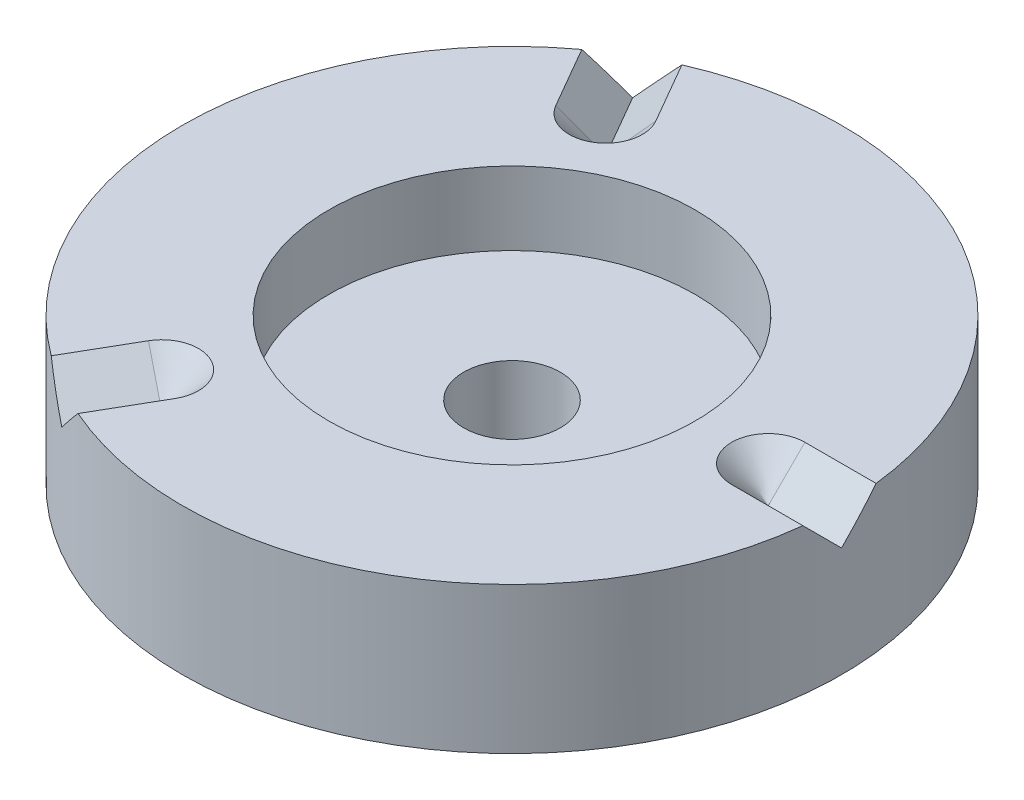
SolidWorks part; units mm, degrees
ref_plane "Front Plane" through (0, 0, 0) normal (0, 0, 1) x (1, 0, 0)
ref_plane "Top Plane" through (0, 0, 0) normal (0, 1, 0) x (1, 0, 0)
ref_plane "Right Plane" through (0, 0, 0) normal (1, 0, 0) x (0, 0, -1)
sketch "Sketch1" plane through (0, 0, 0) normal (0, 1, 0) x (1, 0, 0)
  circle A0 centre (0, 0) radius 22.5
  dimension "D1" = 45
extrude "Boss-Extrude1" add sketch "Sketch1" along normal blind 10
ref_plane "Plane1" through (22.5, 0, 0) normal (1, 0, 0) x (0, 0, -1)
sketch "Sketch4" plane through (0, 10, 0) normal (0, 1, 0) x (1, 0, 0)
  line L0 (27.5, 0) -> (17.5, 0) construction
  line L1 (27.5, -2.5) -> (17.5, -2.5)
  line L2 (27.5, 2.5) -> (17.5, 2.5)
  arc A0 (27.5, -2.5) -> (27.5, 2.5) centre (27.5, 0) ccw
  arc A1 (17.5, 2.5) -> (17.5, -2.5) centre (17.5, 0) ccw
  point P3 (22.5, 0)
  dimension "D1" = 2.5
  dimension "D2" = 17.5
  dimension "D3" = 10
extrude "Cut-Extrude3" cut sketch "Sketch4" against normal blind 2.5
chamfer "Chamfer1" distance 2.5 angle 45 3 edges at (19.9303, 7.5, 2.5) (15, 7.5, 0) (19.9303, 7.5, -2.5)
pattern_circular "CirPattern3" count 3 over 360 about axis through (0, 0, 0) along (0, 1, 0) of "Chamfer1", "Cut-Extrude3"
sketch "Sketch7" plane through (0, 10, 0) normal (0, 1, 0) x (1, 0, 0)
  circle A0 centre (0, 0) radius 12.5
  dimension "D1" = 25
extrude "Cut-Extrude4" cut sketch "Sketch7" against normal blind 5
hole_wizard "M6 Clearance Hole1" positions "Sketch8" profile "Sketch9" hole size "M6" standard "ANSI Metric"
sketch "Sketch8" plane through (0, 5, 0) normal (0, 1, 0) x (1, 0, 0)
  point P0 (0, 0)
sketch "Sketch9" plane through (0, 5, 0) normal (1, 0, 0) x (0, 0, 1)
  line L0 (0, 0) -> (0, 5)
  line L1 (0, 5) -> (3.3, 5)
  line L2 (3.3, 5) -> (3.3, 0)
  line L5 (3.3, 0) -> (0, 0)
  line L11 (0, -6.35) -> (0, 107.95) construction
  dimension "Thru Hole Dia." = 6.6
  dimension "Thru Hole Depth" = 5
